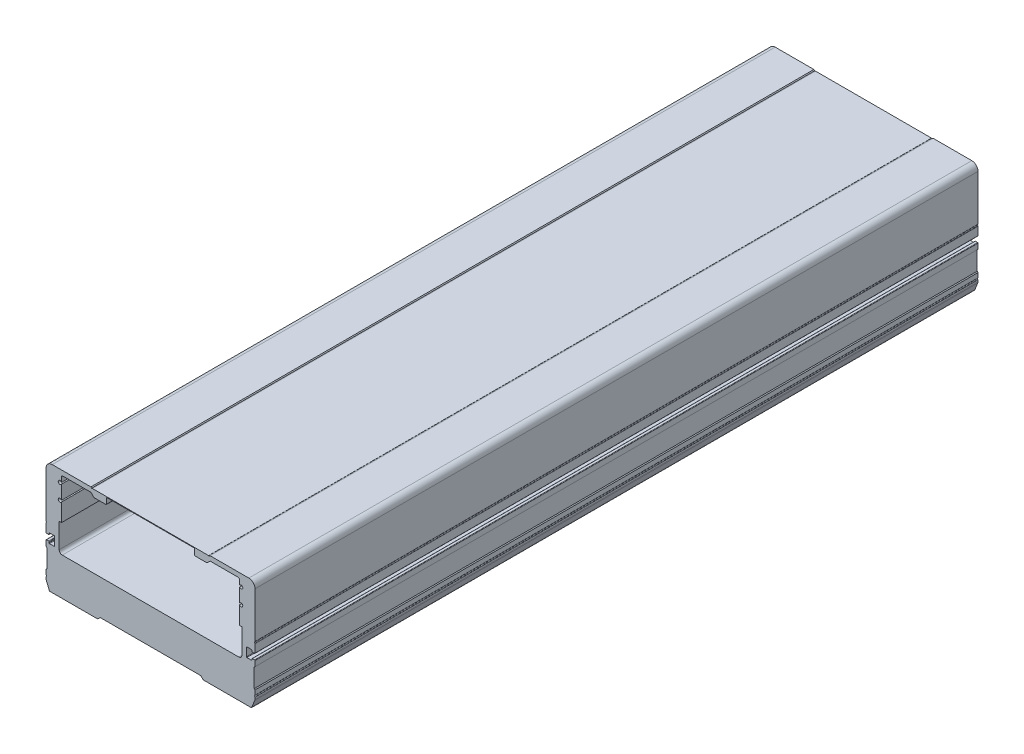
SolidWorks part; units mm, degrees
ref_plane "前视基准面" through (0, 0, 0) normal (0, 0, 1) x (1, 0, 0)
ref_plane "上视基准面" through (0, 0, 0) normal (0, 1, 0) x (1, 0, 0)
ref_plane "右视基准面" through (0, 0, 0) normal (1, 0, 0) x (0, 0, -1)
sketch "草图1" plane through (0, 0, 0) normal (0, 0, 1) x (1, 0, 0)
  line B0 (-57, 22.7) -> (57, 22.7)
  line B1 (-59, 40.3) -> (-59, 24.7)
  line B2 (-57.5, 40.6) -> (-59.3, 40.6)
  line B3 (-57.5, 52.1417) -> (-57.5, 40.6)
  line B4 (-57.5, 62.1417) -> (-57.5, 53.0583)
  line B5 (-57.5, 66.1) -> (-57.5, 63.0583)
  line B6 (-38.5, 67.1) -> (-56.5, 67.1)
  line B7 (-36.5, 65.1) -> (-38.5, 67.1)
  line B8 (-28.8, 65.1) -> (-36.5, 65.1)
  line B9 (-28.5, 69.3) -> (-28.5, 65.4)
  line B10 (28.5, 69.3) -> (-28.5, 69.3)
  line B11 (28.5, 65.4) -> (28.5, 69.3)
  line B12 (36.5, 65.1) -> (28.8, 65.1)
  line B13 (38.5, 67.1) -> (36.5, 65.1)
  line B14 (56.5, 67.1) -> (38.5, 67.1)
  line B15 (57.5, 63.0583) -> (57.5, 66.1)
  line B16 (57.5, 53.0583) -> (57.5, 62.1417)
  line B17 (57.5, 40.6) -> (57.5, 52.1417)
  line B18 (59, 40.6) -> (57.5, 40.6)
  line B19 (59, 24.7) -> (59, 40.6)
  line B20 (-67.5, 66.1) -> (-67.5, 36.6047)
  line B21 (-67.5, 35.3953) -> (-67.5, 30.1)
  line B22 (-67.2, 29.8) -> (-65.8, 29.8)
  line B23 (-65.5, 30.1) -> (-65.5, 30.7)
  line B24 (-65.2, 31) -> (-62.3, 31)
  line B25 (-62, 30.7) -> (-62, 25.3)
  line B26 (-62.3, 25) -> (-65.2, 25)
  line B27 (-65.5, 25.3) -> (-65.5, 25.9)
  line B28 (-65.8, 26.2) -> (-67.2, 26.2)
  line B29 (-67.5, 25.9) -> (-67.5, 22.5)
  line B30 (-67.5, 22.5) -> (-67, 22)
  line B31 (-67, 22) -> (-67, 10)
  line B32 (-67, 10) -> (-67.5, 9.5)
  line B33 (-67.5, 9.5) -> (-67.5, 6.6047)
  line B34 (-67.5, 5.3953) -> (-67.5, 4.382)
  line B35 (-67.3592, 3.6449) -> (-65.5064, -1.0289)
  line B36 (-65.16, -1.6) -> (-34.1, -1.6)
  line B37 (-34.1, -1.6) -> (-32.5, 0)
  line B38 (-32.5, 0) -> (32.5, 0)
  line B39 (32.5, 0) -> (34.1, -1.6)
  line B40 (34.1, -1.6) -> (65.16, -1.6)
  line B41 (65.5064, -1.0289) -> (67.3592, 3.6449)
  line B42 (67.5, 4.382) -> (67.5, 5.3953)
  line B43 (67.5, 6.6047) -> (67.5, 9.5)
  line B44 (67.5, 9.5) -> (67, 10)
  line B45 (67, 10) -> (67, 22)
  line B46 (67, 22) -> (67.5, 22.5)
  line B47 (67.5, 22.5) -> (67.5, 25.9)
  line B48 (67.2, 26.2) -> (65.8, 26.2)
  line B49 (65.5, 25.9) -> (65.5, 25.3)
  line B50 (65.2, 25) -> (62.3, 25)
  line B51 (62, 25.3) -> (62, 30.7)
  line B52 (62.3, 31) -> (65.2, 31)
  line B53 (65.5, 30.7) -> (65.5, 30.1)
  line B54 (65.8, 29.8) -> (67.2, 29.8)
  line B55 (67.5, 30.1) -> (67.5, 35.3953)
  line B56 (67.5, 36.6047) -> (67.5, 66.1)
  line B57 (63.5, 70.1) -> (38.5, 70.1)
  line B58 (38.5, 70.1) -> (38, 69.6)
  line B59 (38, 69.6) -> (37.5, 69.6)
  line B60 (37.5, 69.6) -> (37.5, 69.7)
  line B61 (37.5, 69.7) -> (-37.5, 69.7)
  line B62 (-37.5, 69.7) -> (-37.5, 69.6)
  line B63 (-37.5, 69.6) -> (-38, 69.6)
  line B64 (-38, 69.6) -> (-38.5, 70.1)
  line B65 (-38.5, 70.1) -> (-63.5, 70.1)
  arc B66 (-59, 24.7) -> (-57, 22.7) centre (-57, 24.7) ccw
  arc B67 (-59, 40.3) -> (-59.3, 40.6) centre (-59.3, 40.3) ccw
  arc B68 (-57.5, 53.0583) -> (-57.5, 52.1417) centre (-58.5, 52.6) ccw
  arc B69 (-57.5, 63.0583) -> (-57.5, 62.1417) centre (-58.5, 62.6) ccw
  arc B70 (-56.5, 67.1) -> (-57.5, 66.1) centre (-56.5, 66.1) ccw
  arc B71 (-28.8, 65.1) -> (-28.5, 65.4) centre (-28.8, 65.4) ccw
  arc B72 (28.5, 65.4) -> (28.8, 65.1) centre (28.8, 65.4) ccw
  arc B73 (57.5, 66.1) -> (56.5, 67.1) centre (56.5, 66.1) ccw
  arc B74 (57.5, 62.1417) -> (57.5, 63.0583) centre (58.5, 62.6) ccw
  arc B75 (57.5, 52.1417) -> (57.5, 53.0583) centre (58.5, 52.6) ccw
  arc B76 (57, 22.7) -> (59, 24.7) centre (57, 24.7) ccw
  arc B77 (-67.5, 36.6047) -> (-67.3333, 36.3359) centre (-67.2, 36.6047) ccw
  arc B78 (-67.3333, 35.6641) -> (-67.3333, 36.3359) centre (-67.5, 36) ccw
  arc B79 (-67.3333, 35.6641) -> (-67.5, 35.3953) centre (-67.2, 35.3953) ccw
  arc B80 (-67.5, 30.1) -> (-67.2, 29.8) centre (-67.2, 30.1) ccw
  arc B81 (-65.8, 29.8) -> (-65.5, 30.1) centre (-65.8, 30.1) ccw
  arc B82 (-65.2, 31) -> (-65.5, 30.7) centre (-65.2, 30.7) ccw
  arc B83 (-62, 30.7) -> (-62.3, 31) centre (-62.3, 30.7) ccw
  arc B84 (-62.3, 25) -> (-62, 25.3) centre (-62.3, 25.3) ccw
  arc B85 (-65.5, 25.3) -> (-65.2, 25) centre (-65.2, 25.3) ccw
  arc B86 (-65.5, 25.9) -> (-65.8, 26.2) centre (-65.8, 25.9) ccw
  arc B87 (-67.2, 26.2) -> (-67.5, 25.9) centre (-67.2, 25.9) ccw
  arc B88 (-67.5, 6.6047) -> (-67.3333, 6.3359) centre (-67.2, 6.6047) ccw
  arc B89 (-67.3333, 5.6641) -> (-67.3333, 6.3359) centre (-67.5, 6) ccw
  arc B90 (-67.3333, 5.6641) -> (-67.5, 5.3953) centre (-67.2, 5.3953) ccw
  arc B91 (-67.5, 4.382) -> (-67.3592, 3.6449) centre (-65.5, 4.382) ccw
  arc B92 (-65.5064, -1.0289) -> (-65.16, -1.6) centre (-63.6472, -0.2918) ccw
  arc B93 (65.16, -1.6) -> (65.5064, -1.0289) centre (63.6472, -0.2918) ccw
  arc B94 (67.3592, 3.6449) -> (67.5, 4.382) centre (65.5, 4.382) ccw
  arc B95 (67.5, 5.3953) -> (67.3333, 5.6641) centre (67.2, 5.3953) ccw
  arc B96 (67.3333, 6.3359) -> (67.3333, 5.6641) centre (67.5, 6) ccw
  arc B97 (67.3333, 6.3359) -> (67.5, 6.6047) centre (67.2, 6.6047) ccw
  arc B98 (67.5, 25.9) -> (67.2, 26.2) centre (67.2, 25.9) ccw
  arc B99 (65.8, 26.2) -> (65.5, 25.9) centre (65.8, 25.9) ccw
  arc B100 (65.2, 25) -> (65.5, 25.3) centre (65.2, 25.3) ccw
  arc B101 (62, 25.3) -> (62.3, 25) centre (62.3, 25.3) ccw
  arc B102 (62.3, 31) -> (62, 30.7) centre (62.3, 30.7) ccw
  arc B103 (65.5, 30.7) -> (65.2, 31) centre (65.2, 30.7) ccw
  arc B104 (65.5, 30.1) -> (65.8, 29.8) centre (65.8, 30.1) ccw
  arc B105 (67.2, 29.8) -> (67.5, 30.1) centre (67.2, 30.1) ccw
  arc B106 (67.5, 35.3953) -> (67.3333, 35.6641) centre (67.2, 35.3953) ccw
  arc B107 (67.3333, 36.3359) -> (67.3333, 35.6641) centre (67.5, 36) ccw
  arc B108 (67.3333, 36.3359) -> (67.5, 36.6047) centre (67.2, 36.6047) ccw
  arc B109 (67.5, 66.1) -> (63.5, 70.1) centre (63.5, 66.1) ccw
  arc B110 (-63.5, 70.1) -> (-67.5, 66.1) centre (-63.5, 66.1) ccw
sketch_block_instance "块1-1"
sketch_block "块1"
extrude "凸台-拉伸1" add sketch "草图1" against normal blind 467
hole_wizard " 螺纹孔M6" positions "草图5" profile "草图6" tap size "M6" standard "GB"
sketch "草图5" plane through (0, -1.6, 0) normal (0, -1, 0) x (-1, 0, 0)
  line L5 (65.16, 467) -> (34.1, 467) construction
  line L6 (0, 467) -> (0, 1237.2993) construction
  line L7 (32.5, 467) -> (-32.5, 467) construction
  point P0 (53, 415.5)
  point P2 (-53, 415.5)
  point P12 (53, 265.5)
  point P14 (-53, 265.5)
  point P19 (-53, 65.5)
  point P21 (53, 65.5)
  point P23 (-53, -134.5)
  point P25 (53, -134.5)
  point P27 (-53, -334.5)
  point P29 (53, -334.5)
  point P31 (-53, -534.5)
  point P33 (53, -534.5)
  point P36 (53, -734.5)
  point P38 (-53, -734.5)
  dimension "D1" = 51.5
  dimension "D2" = 150
  dimension "D3" = 200
  dimension "D4" = 200
  dimension "D5" = 200
  dimension "D6" = 200
  dimension "D7" = 200
  dimension "D8" = 106
sketch "草图6" plane through (-53, -1.6, -415.5) normal (1, 0, 0) x (0, 0, -1)
  line L0 (0, 0) -> (0, 16.5022)
  line L1 (0, 16.5022) -> (2.5, 15)
  line L2 (2.5, 15) -> (2.5, 0)
  line L5 (2.5, 0) -> (0, 0)
  line L10 (0, 16.5022) -> (-2.5, 15) construction
  line L11 (0, -6.35) -> (0, 107.95) construction
  dimension "螺纹孔钻头直径" = 5
  dimension "螺纹孔钻头深度" = 15
  dimension "导头角度" = 118
